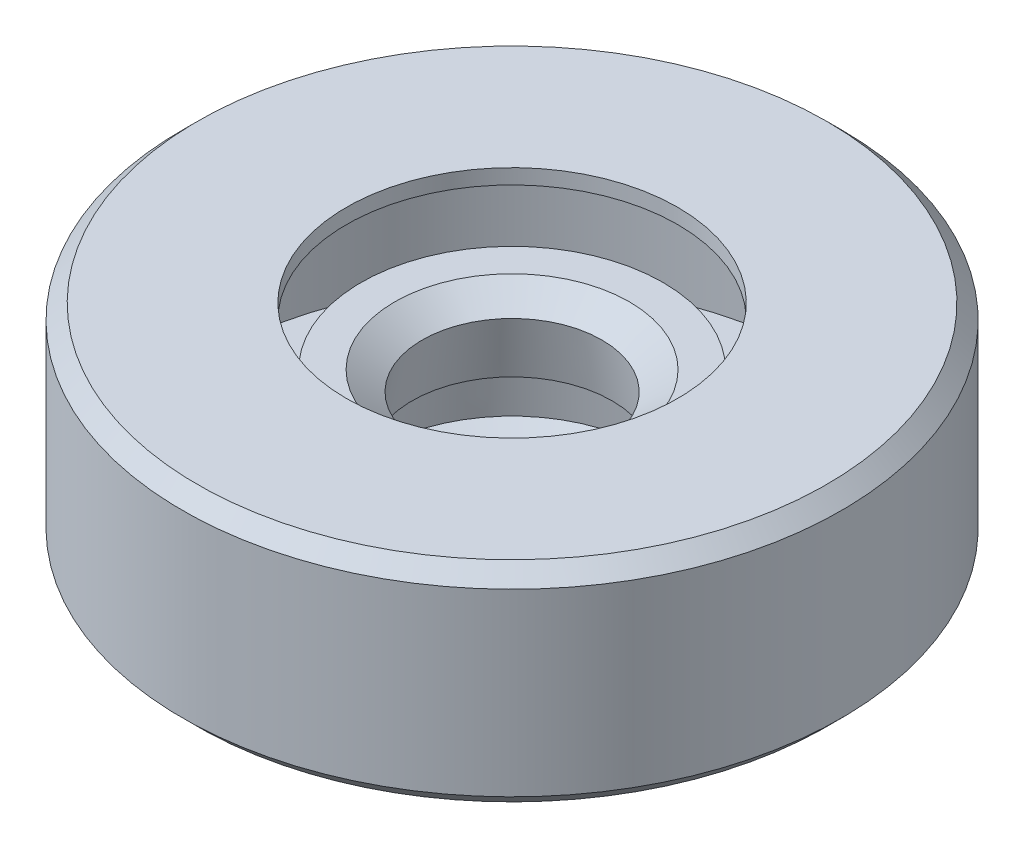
SolidWorks part; units mm, degrees
ref_plane "前视基准面" through (0, 0, 0) normal (0, 0, 1) x (1, 0, 0)
ref_plane "上视基准面" through (0, 0, 0) normal (0, 1, 0) x (1, 0, 0)
ref_plane "右视基准面" through (0, 0, 0) normal (1, 0, 0) x (0, 0, -1)
sketch "草图1" plane through (0, 0, 0) normal (0, 0, 1) x (1, 0, 0)
  line L0 (-4.8389, 3.1034) -> (-5.0288, 0.933)
  line L1 (-4.5647, 0.5) -> (-4.3898, 2.5)
  line L2 (-11, 0.5) -> (-11, 6.5)
  line L3 (-10, 0.5) -> (-10, 6.5)
  line L4 (-11, 0.5) -> (-10.5, 0)
  line L5 (-5.5288, 0.933) -> (-5.0288, 0.933)
  line L6 (-10.5, 0) -> (-5.0085, 0)
  line L7 (-10, 0.5) -> (-5.7788, 0.5)
  line L8 (-5.5288, 0.933) -> (-5.7788, 0.5)
  line L9 (-4.2085, 0) -> (-3.3401, 0.076)
  line L10 (-4.5647, 0.5) -> (-3.3401, 0.076)
  line L11 (-11, 6.5) -> (-10.5, 7)
  line L12 (-10.5, 7) -> (-5.5288, 7)
  line L13 (-10, 6.5) -> (-5.5288, 6.5)
  line L14 (-5.5288, 7) -> (-5.5288, 6.5)
  line L15 (-3.9181, 5.0714) -> (-5.0389, 5.0714)
  line L16 (-5.0389, 5.0714) -> (-5.0389, 3.9506)
  line L17 (-3.3401, 2.5) -> (-3, 4.4286)
  line L18 (-3.3401, 2.5) -> (-4.3898, 2.5)
  line L19 (-3, 4.4286) -> (-3.9181, 5.0714)
  line L20 (-10.5, 0) -> (-10.5, 0.5) construction
  line L21 (0, 0) -> (0, 10.3792) construction
  line L22 (-10.5, 0.5) -> (-10, 0.5) construction
  line L23 (-4.6085, 0) -> (-4.6085, 0.3) construction
  line L24 (-4.9347, 2.0087) -> (-4.4366, 1.9651) construction
  line L25 (-5.0085, 0) -> (-4.6085, 0) construction
  arc A0 (-5.0085, 0) -> (-4.2085, 0) centre (-4.6085, -0.1167) cw
  arc A1 (-5.0389, 3.9506) -> (-4.8389, 3.1034) centre (-4.8389, 3.5506) ccw
  dimension "D11" = 0.4
  dimension "b" = 7
  dimension "D3" = 45
  dimension "D4" = 45
  dimension "D5" = 5
  dimension "D6" = 2.5
  dimension "D7" = 1.9286
  dimension "D8" = 0.6429
  dimension "D9" = 120
  dimension "D10" = 0.2
  dimension "D12" = 0.3
  dimension "D13" = 95
  dimension "D14" = 100
  dimension "D15" = 0.4
  dimension "D16" = 145
  dimension "d1" = 6
  dimension "dm" = 22
  dimension "r" = 0.5
revolve "旋转1" add sketch "草图1" angle 360 about L21
equation "\"D6@草图1\" = \"b@草图1\" / 2 - 1"
equation "\"D7@草图1\" =  ( \"b@草图1\" - \"D6@草图1\" )  / 7 * 3"
equation "\"D8@草图1\" = \"D7@草图1\" / 3"
equation "\"D11@草图1\" = \"r@草图1\" / 5 * 4"
equation "\"D15@草图1\" = \"D11@草图1\""
equation "\"D10@草图1\" =\"D11@草图1\" / 2"
equation "\"D12@草图1\" = \"D11@草图1\" / 4 * 3"
